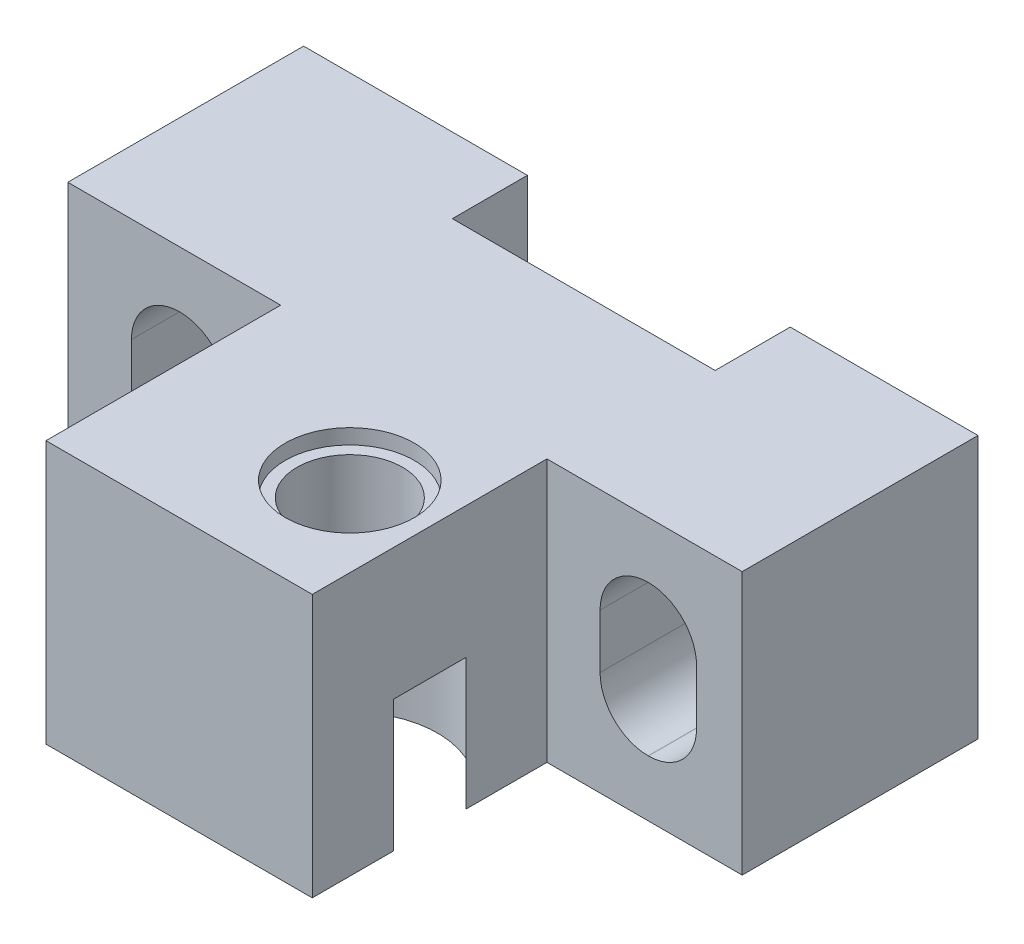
SolidWorks part; units mm, degrees
ref_plane "Front" through (0, 0, 0) normal (0, 0, 1) x (1, 0, 0)
ref_plane "Top" through (0, 0, 0) normal (0, 1, 0) x (1, 0, 0)
ref_plane "Right" through (0, 0, 0) normal (1, 0, 0) x (0, 0, -1)
sketch "Sketch1" plane through (0, 0, 0) normal (0, 0, 1) x (1, 0, 0)
  line L1 (-13.5001, 0) -> (9.3091, 0)
  line L2 (-13.5001, 0) -> (-13.5001, -8.89)
  line L3 (-13.5001, -8.89) -> (9.3091, -8.89)
  line L4 (9.3091, 0) -> (9.3091, -8.89)
  dimension "D1" = 13.5001
  dimension "D2" = 22.8092
  dimension "D3" = 8.89
extrude "Extrude1" add sketch "Sketch1" along normal blind 7.9756
sketch "Sketch2" plane through (0, 0, 0) normal (0, 0, -1) x (-1, 0, 0)
  line L0 (13.5001, -8.89) -> (-9.3091, -8.89) construction
  line L1 (-2.9591, -8.89) -> (5.9309, -8.89)
  line L2 (-2.9591, -8.89) -> (-2.9591, 0)
  line L3 (-2.9591, 0) -> (5.9309, 0)
  line L4 (5.9309, -8.89) -> (5.9309, 0)
  line L5 (-9.3091, 0) -> (13.5001, 0) construction
  line L6 (-9.3091, -8.89) -> (-9.3091, 0) construction
  dimension "D1" = 6.35
  dimension "D2" = 8.89
hole_wizard "#8-32 Tapped Hole1" positions "Sketch4" profile "Sketch3" tap size "#8-32" standard "Ansi Inch"
sketch "Sketch4" plane through (0, 0, 7.9756) normal (0, 0, 1) x (1, 0, 0)
  line L0 (0, 0) -> (0, -8.89) construction
  line L1 (-13.5001, -8.89) -> (9.3091, -8.89) construction
  point P0 (0, -4.445)
sketch "Sketch3" plane through (0, -4.445, 7.9756) normal (1, 0, 0) x (0, -1, 0)
  line L0 (0, 0) -> (0, 8.7274)
  line L1 (0, 8.7274) -> (1.7272, 8.7274)
  line L2 (1.7272, 8.7274) -> (1.7272, 0)
  line L5 (1.7272, 0) -> (0, 0)
  line L10 (0, 8.7274) -> (-1.7272, 8.7274) construction
  line L11 (0, -6.35) -> (0, 107.95) construction
  dimension "Tap Drill Dia." = 3.4544
  dimension "Tap Drill Depth" = 8.7274
  dimension "Drill Angle" = 180
extrude "Cut-Extrude1" cut sketch "Sketch2" against normal blind 2.54
sketch "Sketch7" plane through (0, 0, 7.9756) normal (0, 0, 1) x (1, 0, 0)
  line L0 (2.7051, 0) -> (2.7051, -8.89)
  line L1 (9.3091, 0) -> (-13.5001, 0) construction
  line L2 (-13.5001, -8.89) -> (9.3091, -8.89) construction
  line L3 (2.7051, -8.89) -> (-6.3001, -8.89)
  line L4 (-6.3001, -8.89) -> (-6.3001, 0)
  line L5 (-6.3001, 0) -> (2.7051, 0)
  line L6 (9.3091, -8.89) -> (9.3091, 0) construction
  line L7 (-13.5001, 0) -> (-13.5001, -8.89) construction
  dimension "D1" = 6.604
  dimension "D2" = 7.2
extrude "New" add sketch "Sketch7" along normal blind 7.9375
sketch "Sketch5" plane through (0, 0, 7.9756) normal (0, 0, 1) x (1, 0, 0)
  line L0 (2.9591, -4.445) -> (9.3091, -4.445) construction
  line L1 (4.5022, -1.905) -> (7.766, -1.905)
  line L2 (4.5022, -1.905) -> (4.5022, -6.985)
  line L3 (4.5022, -6.985) -> (7.766, -6.985)
  line L4 (7.766, -1.905) -> (7.766, -6.985)
  line L5 (2.9591, 0) -> (2.9591, -8.89) construction
  line L6 (9.3091, -8.89) -> (9.3091, 0) construction
  line L7 (6.1341, 0) -> (6.1341, -8.89) construction
  line L8 (-13.5001, -8.89) -> (-6.3001, -8.89) construction
  line L9 (9.3091, 0) -> (2.7051, 0) construction
  point P14 (6.1341, -4.445)
  point P15 (6.1341, -1.905)
  point P18 (4.5022, -4.445)
  dimension "D1" = 3.2639
  dimension "D2" = 1.905
extrude "Cut-Extrude2" cut sketch "Sketch5" against normal through all
fillet "Fillet1" radius 1.6256 4 edges at (4.5022, -1.905, 3.9878) (7.766, -1.905, 3.9878) (7.766, -6.985, 3.9878) (4.5022, -6.985, 3.9878)
sketch "Sketch6" plane through (0, 0, 7.9756) normal (0, 0, 1) x (1, 0, 0)
  line L0 (-5.9309, -1.905) -> (-13.5001, -1.905) construction
  line L1 (-11.3474, -1.905) -> (-8.0835, -1.905)
  line L2 (-11.3474, -1.905) -> (-11.3474, -6.985)
  line L3 (-11.3474, -6.985) -> (-8.0835, -6.985)
  line L4 (-8.0835, -1.905) -> (-8.0835, -6.985)
  line L5 (-5.9309, -8.89) -> (-5.9309, 0) construction
  line L6 (-13.5001, 0) -> (-13.5001, -8.89) construction
  point P10 (-9.7155, -1.905)
  dimension "D1" = 3.2639
extrude "Cut-Extrude3" cut sketch "Sketch6" against normal through all
fillet "Fillet2" radius 1.6256 4 edges at (-11.3474, -6.985, 3.9878) (-8.0835, -6.985, 3.9878) (-8.0835, -1.905, 3.9878) (-11.3474, -1.905, 3.9878)
sketch "Sketch8" plane through (0, 0, 0) normal (0, 1, 0) x (-1, 0, 0)
  circle A0 centre (0, 11.938) radius 1.7844
  dimension "D2" = 3.5687
  dimension "D1" = 11.938
extrude "Cut-Extrude4" cut sketch "Sketch8" against normal through all
sketch "Sketch9" plane through (0, -8.89, 0) normal (0, -1, 0) x (1, 0, 0)
  circle A0 centre (0, 11.938) radius 2.9718
  dimension "D1" = 5.9436
extrude "Cut-Extrude5" cut sketch "Sketch9" against normal blind 4.445
sketch "Sketch10" plane through (0, 0, 0) normal (0, 1, 0) x (1, 0, 0)
  circle A0 centre (0, -11.938) radius 2.1844
  dimension "D1" = 4.3688
extrude "Cut-Extrude6" cut sketch "Sketch10" against normal blind 0.508
